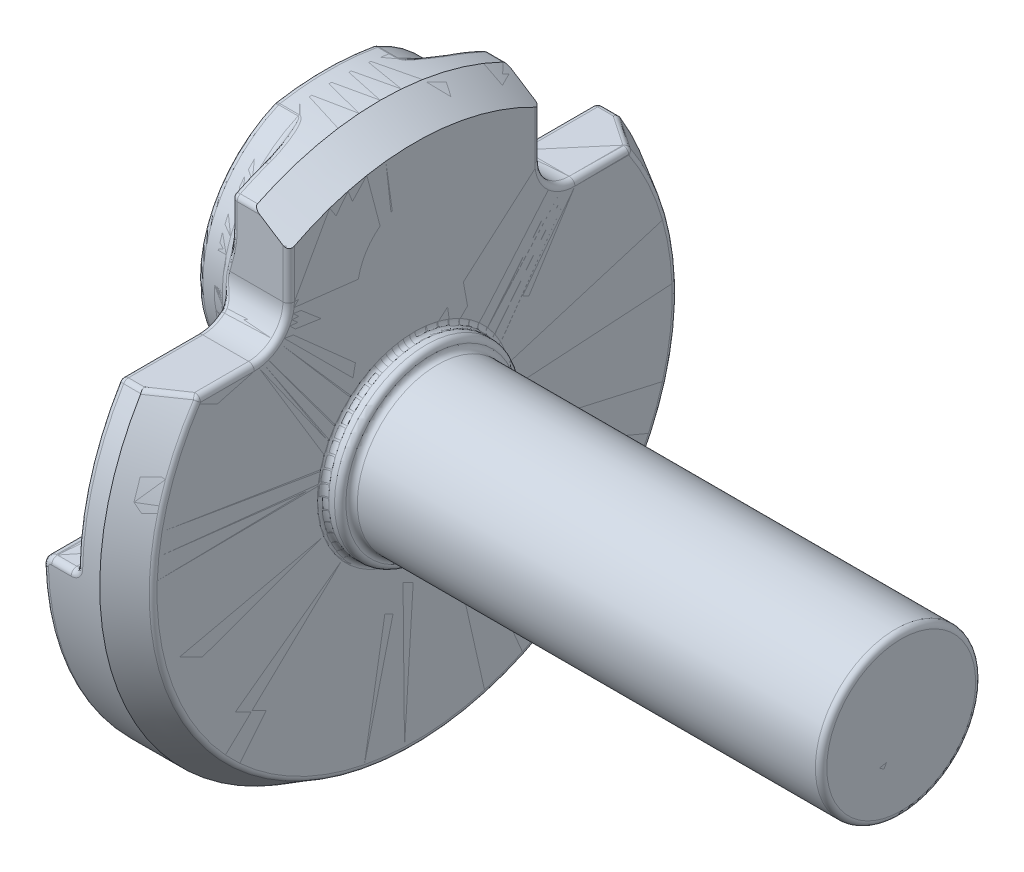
SolidWorks part; units mm, degrees
ref_plane "Plan de face" through (0, 0, 0) normal (0, 0, 1) x (1, 0, 0)
ref_plane "Plan de dessus" through (0, 0, 0) normal (0, 1, 0) x (1, 0, 0)
ref_plane "Plan de droite" through (0, 0, 0) normal (1, 0, 0) x (0, 0, -1)
imported_body "Importée1"
sketch "Esquisse1" plane through (0, 0, 0) normal (1, 0, 0) x (0, 0, -1)
  circle A0 centre (0, 0) radius 6
  dimension "D1" = 12
extrude "L-Roult" cut sketch "Esquisse1" along normal through all flip side to cut
ref_plane "Plan1" through (18.5, 0, 0) normal (1, 0, 0) x (0, 0, -1)
sketch "Esquisse2" plane through (18.5, 0, 0) normal (1, 0, 0) x (0, 0, -1)
  circle A0 centre (0, 0) radius 6 construction
  circle A1 centre (0, 0) radius 6
extrude "Enlèv. mat.-Extru.2" cut sketch "Esquisse2" along normal blind 13 draft 5.71 flip side to cut
sketch "Esquisse3" plane through (31.5, 0, 0) normal (-1, 0, 0) x (0, 0, 1)
  circle A0 centre (0, 0) radius 4
  dimension "D1" = 8
extrude "Enlèv. mat.-Extru.3" cut sketch "Esquisse3" against normal through all flip side to cut
sketch "Esquisse4" plane through (31.5, 0, 0) normal (1, 0, 0) x (0, 0, -1)
  circle A0 centre (0, 0) radius 3.25
  dimension "D1" = 6.5
extrude "Enlèv. mat.-Extru.4" cut sketch "Esquisse4" along normal blind 2 flip side to cut
chamfer "Chanfrein1" distance 1 angle 45 1 edges at (42, 0, 4)
sketch "Esquisse5" plane through (0, 0, 0) normal (0, 0, 1) x (1, 0, 0)
  line L0 (0, -26.9605) -> (0, 26.9605) construction
  line L1 (26.9605, 0) -> (-26.9605, 0) construction
  circle A0 centre (25, 8.4) radius 5
  dimension "D2" = 10
  dimension "D1" = 25
  dimension "D3" = 8.4
extrude "R_Clavette" cut sketch "Esquisse5" against normal mid plane 3
sketch "Esquisse6" plane through (0, 0, 0) normal (1, 0, 0) x (0, 0, -1)
  line L0 (0, 27.2119) -> (0, -27.2119) construction
  circle A0 centre (0, 14) radius 5
  dimension "D1" = 10
  dimension "D2" = 14
extrude "MiP_R-Axe" cut sketch "Esquisse6" against normal through all
ref_plane "Plan2" through (-7, 0, 0) normal (1, 0, 0) x (0, 0, -1)
sketch "Esquisse7" plane through (-7, 0, 0) normal (1, 0, 0) x (0, 0, -1)
  circle A0 centre (0, 14) radius 11
  circle A1 centre (0, 14) radius 5 construction
  arc A2 (-4.3747, 24.0927) -> (4.3747, 24.0927) centre (0, 14) ccw construction
extrude "Enlèv. mat.-Extru.7" cut sketch "Esquisse7" against normal through all
